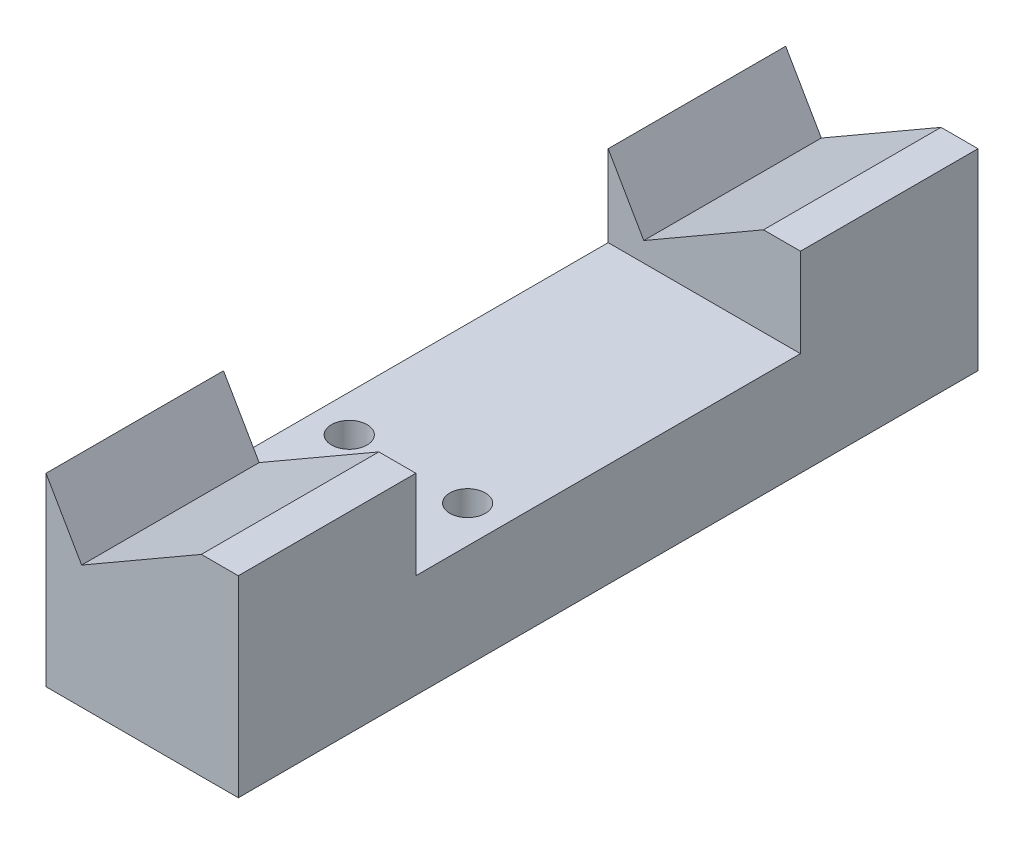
SolidWorks part; units mm, degrees
ref_plane "Face" through (0, 0, 0) normal (0, 0, 1) x (1, 0, 0)
ref_plane "Dessus" through (0, 0, 0) normal (0, 1, 0) x (1, 0, 0)
ref_plane "Droite" through (0, 0, 0) normal (1, 0, 0) x (0, 0, -1)
sketch "Esquisse1" plane through (0, 0, 0) normal (0, 0, 1) x (1, 0, 0)
  line L0 (6.5, 13) -> (4, 13)
  line L1 (-6.5, 0) -> (6.5, 0)
  line L2 (-6.5, 0) -> (-6.5, 12.5)
  line L4 (6.5, 0) -> (6.5, 13)
  line L5 (4, 13) -> (-4.0915, 8.3284)
  line L6 (-4.0915, 8.3284) -> (-6.5, 12.5)
  dimension "D1" = 2.5
  dimension "D2" = 13
  dimension "D3" = 13
  dimension "D4" = 12.5
  dimension "D5" = 30
  dimension "D6" = 6.5
extrude "Extrusion1" add sketch "Esquisse1" along normal blind 50
sketch "Esquisse2" plane through (6.5, 0, 0) normal (1, 0, 0) x (0, 0, -1)
  line L0 (0, 0) -> (0, 13) construction
  line L1 (-38, 7) -> (-12, 7)
  line L2 (-38, 7) -> (-38, 20.5517)
  line L3 (-38, 20.5517) -> (-12, 20.5517)
  line L4 (-12, 7) -> (-12, 20.5517)
  line L5 (-50, 0) -> (0, 0) construction
  dimension "D1" = 26
  dimension "D2" = 12
  dimension "D3" = 7
extrude "Enlèv. mat.-Extru.1" cut sketch "Esquisse2" against normal through all
hole_wizard "Trou taraudé M3x0.51" positions "Esquisse4" profile "Esquisse3" tap size "M3x0.5" standard "ISO"
sketch "Esquisse4" plane through (0, 7, 0) normal (0, 1, 0) x (-1, 0, 0)
  circle A0 centre (-4, 32) radius 1.7 construction
  circle A1 centre (4, 32) radius 2.75 construction
  point P0 (4, 32)
  point P1 (-4, 32)
sketch "Esquisse3" plane through (-4, 7, 32) normal (1, 0, 0) x (0, 0, 1)
  line L0 (0, 0) -> (0, 7)
  line L1 (0, 7) -> (1.2, 7)
  line L2 (1.2, 7) -> (1.2, 0)
  line L5 (1.2, 0) -> (0, 0)
  line L11 (0, -6.35) -> (0, 107.95) construction
  dimension "Diamètre du trou pour taraudage jusqu'au prochain" = 2.4
  dimension "Profondeur du trou pour taraudage jusqu'au prochain" = 7
